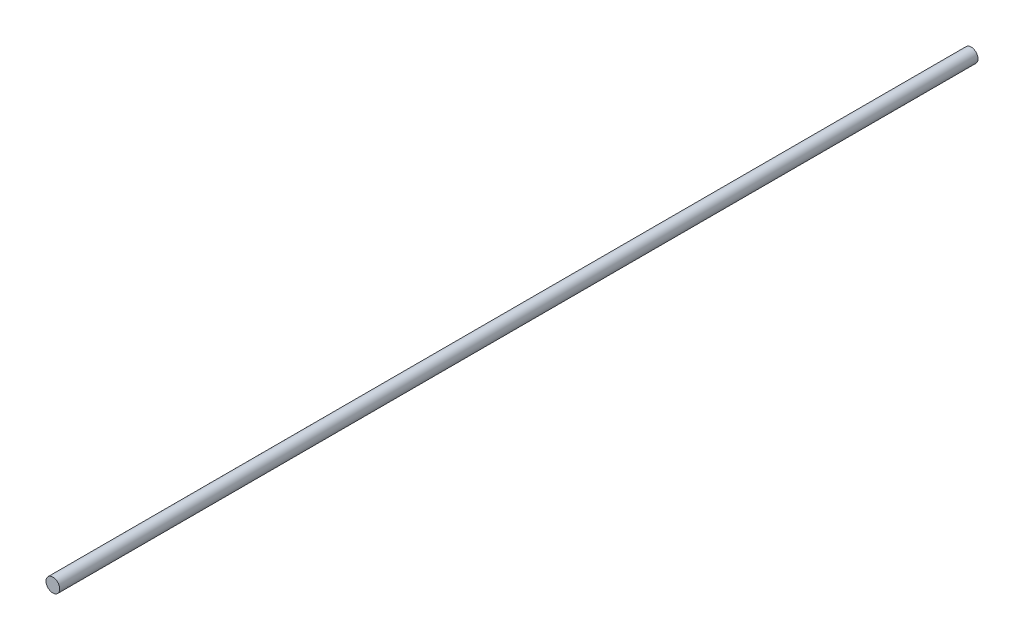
SolidWorks part; units mm, degrees
ref_plane "Front Plane" through (0, 0, 0) normal (0, 0, 1) x (1, 0, 0)
ref_plane "Top Plane" through (0, 0, 0) normal (0, 1, 0) x (1, 0, 0)
ref_plane "Right Plane" through (0, 0, 0) normal (1, 0, 0) x (0, 0, -1)
sketch "Sketch1" plane through (0, 0, 0) normal (0, 0, 1) x (1, 0, 0)
  circle A0 centre (0, 0) radius 0.762
  dimension "D1" = 1.524
extrude "Boss-Extrude1" add sketch "Sketch1" along normal blind 101.6
sketch "Sketch2" plane through (0, 0, 0) normal (1, 0, 0) x (0, 0, -1)
  circle A0 centre (0, 0) radius 3.175
  dimension "D1" = 6.35
extrude "Boss-Extrude2" [suppressed] add sketch "Sketch2" along normal mid plane 25.4
sketch "Sketch3" plane through (0, 0, 0) normal (1, 0, 0) x (0, 0, -1)
  line L0 (0, 0) -> (-110.3854, 0) construction
